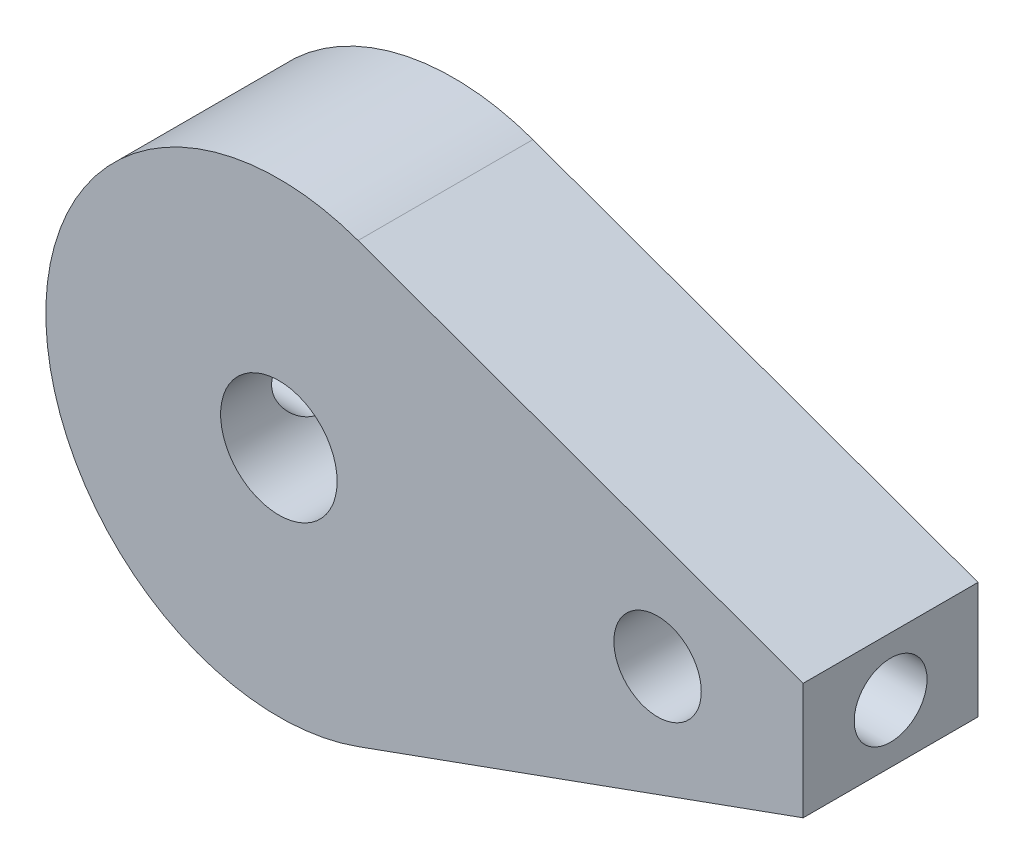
SolidWorks part; units mm, degrees
ref_plane "Front" through (0, 0, 0) normal (0, 0, 1) x (1, 0, 0)
ref_plane "Top" through (0, 0, 0) normal (0, 1, 0) x (1, 0, 0)
ref_plane "Right" through (0, 0, 0) normal (1, 0, 0) x (0, 0, -1)
sketch "Esquisse1" plane through (0, 0, 0) normal (0, 0, 1) x (1, 0, 0)
  line L0 (50, 0) -> (-50, 0) construction
  line L1 (0, -2) -> (0, 2)
  line L2 (0, -50) -> (0, 50) construction
  line L3 (0, 2) -> (-15.2804, 7.5235)
  line L4 (-28.3302, 0) -> (5.003, 0) construction
  line L5 (0, -2) -> (-15.2804, -7.5235)
  arc A0 (-15.2804, 7.5235) -> (-15.2804, -7.5235) centre (-18, 0) ccw
  circle A1 centre (-5, 0) radius 1.5
  circle A2 centre (-18, 0) radius 2
  point P15 (0, 0)
  dimension "D1" = 16
  dimension "D4" = 3
  dimension "D6" = 4
  dimension "D2" = 18
  dimension "D3" = 2
  dimension "D5" = 5
extrude "Boss.-Extru.1" add sketch "Esquisse1" along normal blind 6
hole_wizard "Trou taraudé M31" positions "Esquisse3" profile "Esquisse2" tap size "M3" standard "ISO"
sketch "Esquisse3" plane through (0, 0, 0) normal (1, 0, 0) x (0, 0, -1)
  line L0 (0, -2) -> (0, 2) construction
  point P0 (-3, 0)
  dimension "D1" = 3
sketch "Esquisse2" plane through (0, 0, 3) normal (0, 1, 0) x (0, 0, -1)
  line L0 (0, 0) -> (0, 3.5)
  line L1 (0, 3.5) -> (1.25, 3.5)
  line L2 (1.25, 3.5) -> (1.25, 0)
  line L5 (1.25, 0) -> (0, 0)
  line L11 (0, -6.35) -> (0, 107.95) construction
  dimension "Diamètre du trou pour taraudage jusqu'au prochain" = 2.5
  dimension "Profondeur du trou pour taraudage jusqu'au prochain" = 3.5
ref_plane "Plan1" through (-26, 0, 0) normal (1, 0, 0) x (0, 0, -1)
hole_wizard "Trou taraudé M32" positions "Esquisse5" profile "Esquisse4" tap size "M3" standard "ISO"
sketch "Esquisse5" plane through (-26, 0, 0) normal (1, 0, 0) x (0, 0, -1)
  line L0 (0, -8) -> (0, 8) construction
  point P0 (-3, 0)
  point P3 (0, 0)
  dimension "D1" = 3
sketch "Esquisse4" plane through (-26, 0, 3) normal (0, 1, 0) x (0, 0, 1)
  line L0 (0, 0) -> (0, 6)
  line L1 (0, 6) -> (1.25, 6)
  line L2 (1.25, 6) -> (1.25, 0)
  line L5 (1.25, 0) -> (0, 0)
  line L11 (0, -6.35) -> (0, 107.95) construction
  dimension "Diamètre du trou pour taraudage jusqu'au prochain" = 2.5
  dimension "Profondeur du trou pour taraudage jusqu'au prochain" = 6
